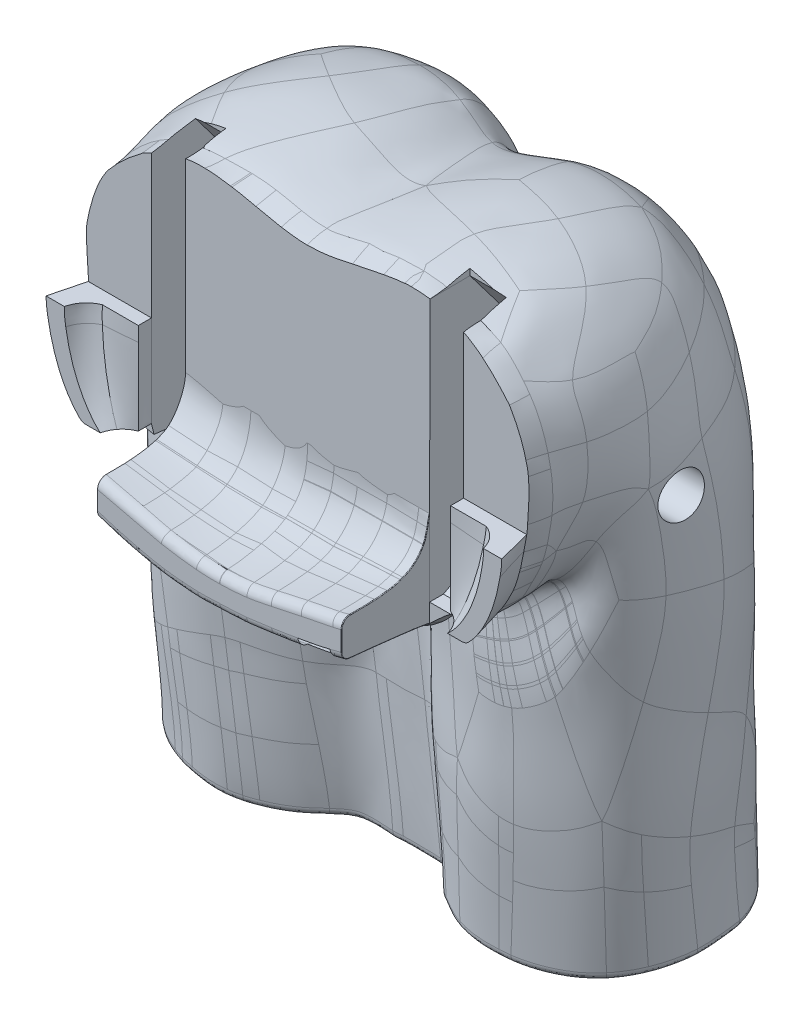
SolidWorks part; units mm, degrees
ref_plane "Front Plane" through (0, 0, 0) normal (0, 0, 1) x (1, 0, 0)
ref_plane "Top Plane" through (0, 0, 0) normal (0, 1, 0) x (1, 0, 0)
ref_plane "Right Plane" through (0, 0, 0) normal (1, 0, 0) x (0, 0, -1)
imported_body "Surface-Imported2"
surface "Surface-Fill1"
